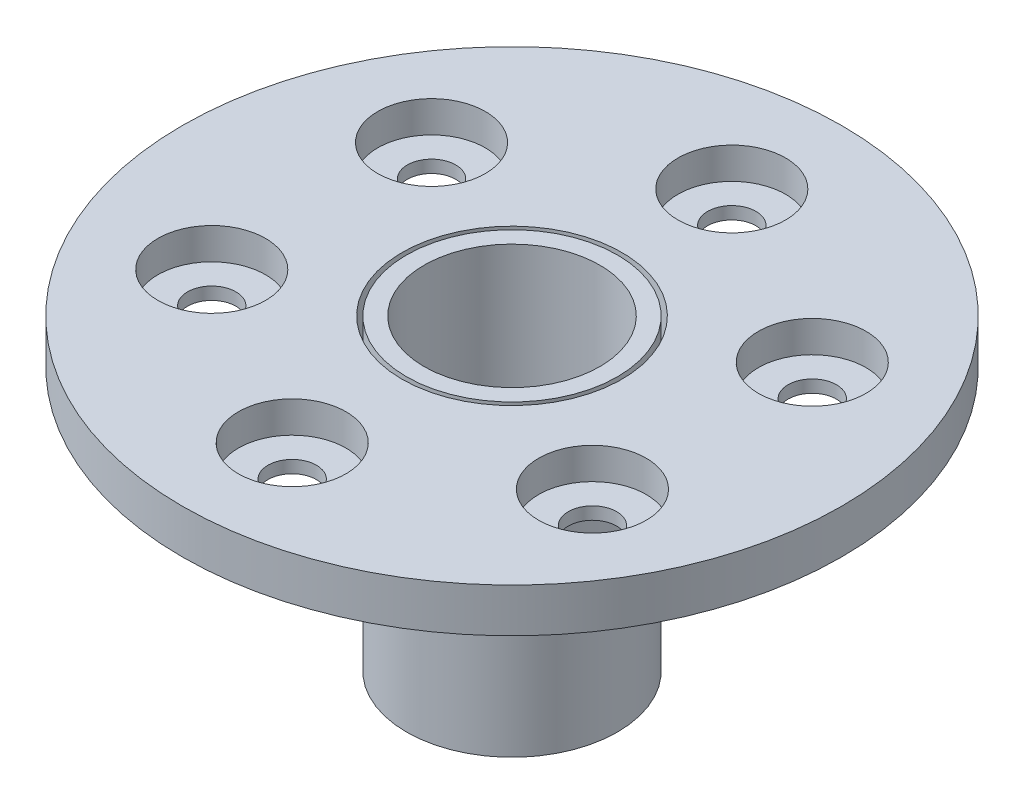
SolidWorks part; units mm, degrees
ref_plane "Front Plane" through (0, 0, 0) normal (0, 0, 1) x (1, 0, 0)
ref_plane "Top Plane" through (0, 0, 0) normal (0, 1, 0) x (1, 0, 0)
ref_plane "Right Plane" through (0, 0, 0) normal (1, 0, 0) x (0, 0, -1)
sketch "Sketch1" plane through (0, 0, 0) normal (0, 1, 0) x (1, 0, 0)
  circle A0 centre (0, 0) radius 37.5
  circle A1 centre (0, 0) radius 12.5
  dimension "D1" = 75
  dimension "D2" = 25
extrude "Extrude1" add sketch "Sketch1" along normal blind 5
sketch "Sketch2" plane through (0, 5, 0) normal (0, 1, 0) x (-1, 0, 0)
  circle A0 centre (0, 0) radius 10
  circle A1 centre (0, 0) radius 12
  dimension "D1" = 20
  dimension "D2" = 2
extrude "Extrude2" add sketch "Sketch2" against normal blind 35
hole_wizard "CBORE for M5 Hex Head Bolt1" positions "Sketch5" profile "Sketch4" counterbore size "M5" standard "Ansi Metric"
sketch "Sketch5" plane through (0, 5, 0) normal (0, 1, 0) x (-1, 0, 0)
  line L0 (0, 12.5) -> (0, 37.5) construction
  circle A0 centre (0, 0) radius 37.5 construction
  circle A1 centre (0, 0) radius 12.5 construction
  point P0 (0, 25)
sketch "Sketch4" plane through (0, 5, 25) normal (1, 0, 0) x (0, 0, 1)
  line L0 (0, 0) -> (0, 5)
  line L1 (0, 5) -> (2.75, 5)
  line L3 (2.75, 5) -> (2.75, 3.58)
  line L4 (2.75, 3.58) -> (6.12, 3.58)
  line L5 (6.12, 3.58) -> (6.12, 0)
  line L7 (6.12, 0) -> (0, 0)
  line L11 (0, -6.35) -> (0, 107.95) construction
  dimension "Thru Hole Dia." = 5.5
  dimension "Thru Hole Depth" = 5
  dimension "C'Bore Dia." = 12.24
  dimension "C'Bore Depth" = 3.58
pattern_circular "CirPattern1" count 6 over 360 about axis through (0, 0, 0) along (0, 1, 0) of "CBORE for M5 Hex Head Bolt1"
